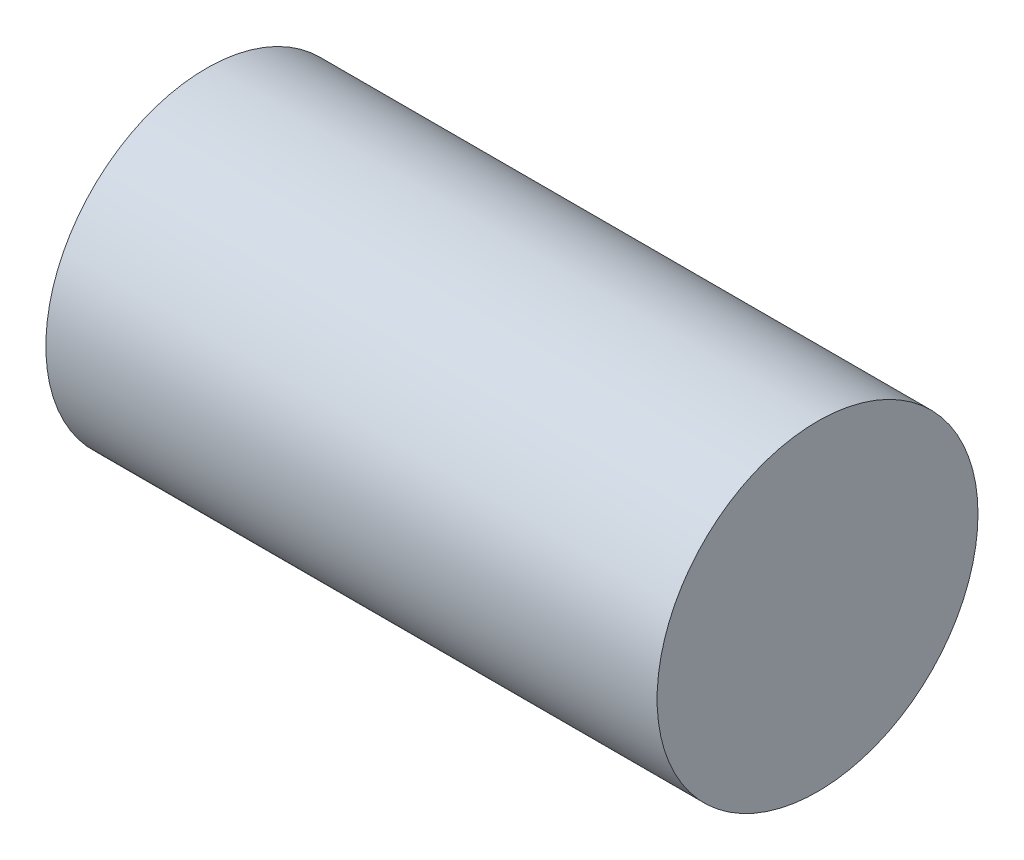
SolidWorks part; units mm, degrees
ref_plane "Спереди" through (0, 0, 0) normal (0, 0, 1) x (1, 0, 0)
ref_plane "Сверху" through (0, 0, 0) normal (0, 1, 0) x (1, 0, 0)
ref_plane "Справа" through (0, 0, 0) normal (1, 0, 0) x (0, 0, -1)
other "Configuration Table"
sketch "Эскиз1" plane through (0, 0, 0) normal (1, 0, 0) x (0, 0, -1)
  circle A0 centre (-31.2491, 14.1087) radius 21
  dimension "D1" = 42
extrude "Бобышка-Вытянуть1" add sketch "Эскиз1" along normal blind 80
